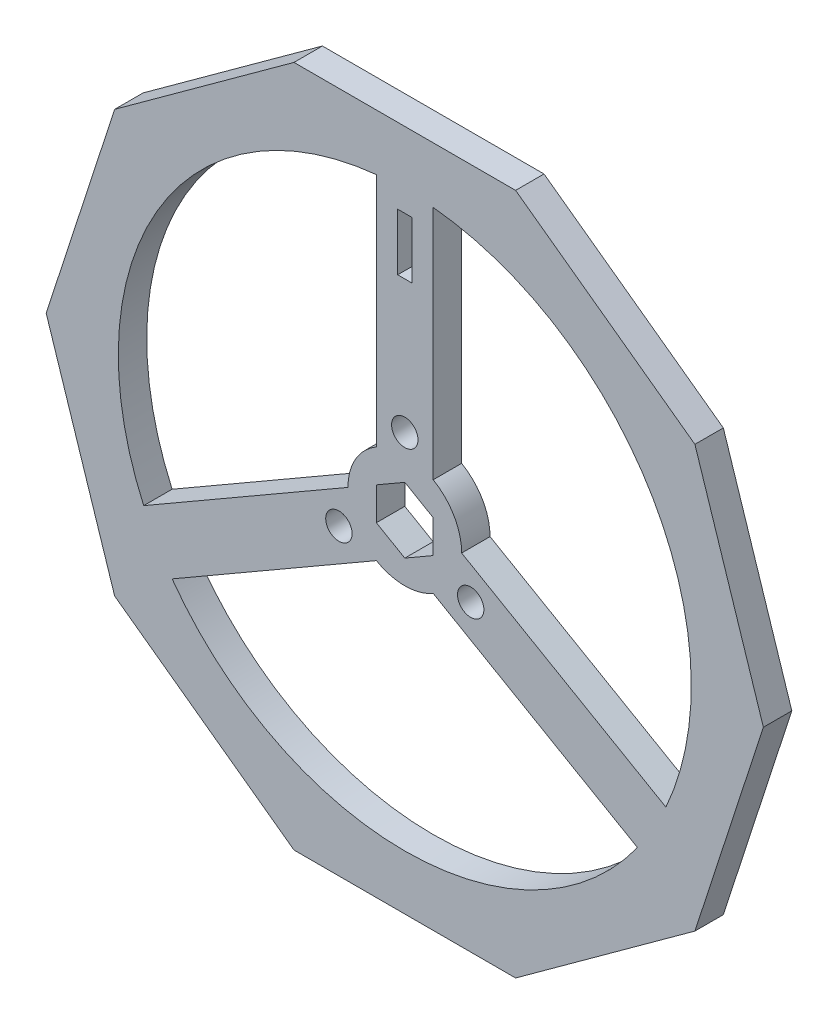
SolidWorks part; units mm, degrees
ref_plane "Front Plane" through (0, 0, 0) normal (0, 0, 1) x (1, 0, 0)
ref_plane "Top Plane" through (0, 0, 0) normal (0, 1, 0) x (1, 0, 0)
ref_plane "Right Plane" through (0, 0, 0) normal (1, 0, 0) x (0, 0, -1)
sketch "Sketch1" plane through (0, 0, 0) normal (0, 0, 1) x (1, 0, 0)
  line L0 (0, 0) -> (0, 32.004) construction
  line L1 (3.175, -1.8331) -> (3.175, 1.8331)
  line L2 (3.175, 1.8331) -> (0, 3.6662)
  line L3 (0, 3.6662) -> (-3.175, 1.8331)
  line L4 (-3.175, 1.8331) -> (-3.175, -1.8331)
  line L5 (-3.175, -1.8331) -> (0, -3.6662)
  line L6 (0, -3.6662) -> (3.175, -1.8331)
  line L7 (0, 0) -> (-27.7163, -16.002) construction
  line L8 (3.175, 31.8461) -> (3.175, 5.4993)
  line L9 (-3.175, 31.8461) -> (-3.175, 5.4993)
  line L10 (-3.175, 18.6727) -> (3.175, 18.6727) construction
  line L11 (29.167, -13.1734) -> (6.35, 0)
  line L12 (25.992, -18.6727) -> (3.175, -5.4993)
  line L13 (-25.992, -18.6727) -> (-3.175, -5.4993)
  line L14 (-29.167, -13.1734) -> (-6.35, 0)
  line L16 (32.4098, 23.5471) -> (12.3794, 38.1)
  line L17 (12.3794, 38.1) -> (-12.3794, 38.1)
  line L18 (-12.3794, 38.1) -> (-32.4098, 23.5471)
  line L19 (-32.4098, 23.5471) -> (-40.0607, 0)
  line L20 (-40.0607, 0) -> (-32.4098, -23.5471)
  line L21 (-32.4098, -23.5471) -> (-12.3794, -38.1)
  line L22 (-12.3794, -38.1) -> (12.3794, -38.1)
  line L23 (12.3794, -38.1) -> (32.4098, -23.5471)
  line L24 (32.4098, -23.5471) -> (40.0607, 0)
  line L25 (40.0607, 0) -> (32.4098, 23.5471)
  line L26 (-0.7938, 29.6945) -> (0.7938, 29.6945)
  line L27 (-0.7938, 29.6945) -> (-0.7937, 23.3445)
  line L28 (-0.7937, 23.3445) -> (0.7937, 23.3445)
  line L29 (0.7938, 29.6945) -> (0.7937, 23.3445)
  circle A1 centre (0, 0) radius 3.175 construction
  circle A2 centre (0, 0) radius 6.35 construction
  circle A3 centre (0, 0) radius 32.004 construction
  arc A4 (-6.35, 0) -> (-3.175, 5.4993) centre (0, 0) cw
  arc A5 (6.35, 0) -> (3.175, 5.4993) centre (0, 0) ccw
  arc A6 (3.175, -5.4993) -> (-3.175, -5.4993) centre (0, 0) cw
  arc A7 (-3.175, 31.8461) -> (-29.167, -13.1734) centre (0, 0) ccw
  arc A8 (3.175, 31.8461) -> (29.167, -13.1734) centre (0, 0) cw
  arc A9 (25.992, -18.6727) -> (-25.992, -18.6727) centre (0, 0) cw
  circle A10 centre (0, 0) radius 38.1 construction
  point P20 (0, 18.6727)
  point P31 (0, 0)
  point P44 (0, 23.3445)
  dimension "D1" = 76.2
  dimension "D3" = 12.7
  dimension "D4" = 64.008
  dimension "D2" = 6.35
  dimension "D5" = 120
  dimension "D6" = 6.35
  dimension "D8" = 1.5875
  dimension "D9" = 6.35
  dimension "D7" = 3
extrude "Boss-Extrude1" add sketch "Sketch1" along normal blind 3.175
hole_wizard "#4 Clearance Hole1" positions "Sketch3" profile "Sketch2" hole size "#4" standard "ANSI Inch"
sketch "Sketch3" plane through (0, 0, 3.175) normal (0, 0, 1) x (1, 0, 0)
  point P0 (0, 8.5)
  point P13 (0, 8.5)
  point P14 (0, 8.5)
  point P15 (0, 8.5)
  point P23 (7.3612, -4.25)
  point P24 (-7.3612, -4.25)
  dimension "D1" = 8.5
  dimension "D2" = 3
sketch "Sketch2" plane through (0, 8.5, 3.175) normal (1, 0, 0) x (0, -1, 0)
  line L0 (0, 0) -> (0, 3.175)
  line L1 (0, 3.175) -> (1.4732, 3.175)
  line L2 (1.4732, 3.175) -> (1.4732, 0)
  line L5 (1.4732, 0) -> (0, 0)
  line L11 (0, -6.35) -> (0, 107.95) construction
  dimension "Thru Hole Dia." = 2.9464
  dimension "Thru Hole Depth" = 3.175
